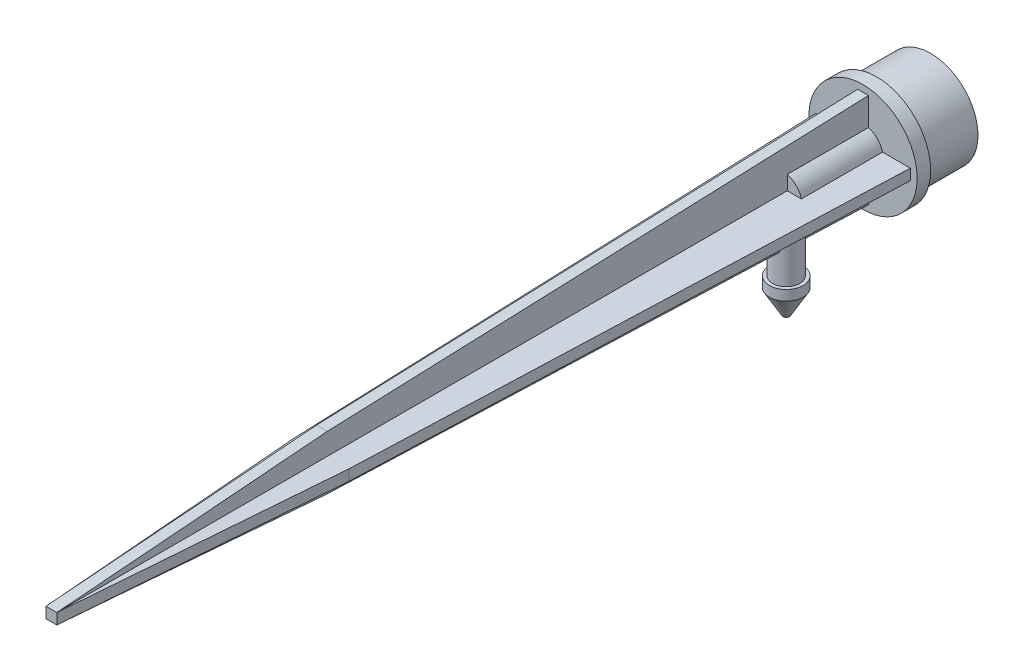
SolidWorks part; units mm, degrees
ref_plane "Plan de face" through (0, 0, 0) normal (0, 0, 1) x (1, 0, 0)
ref_plane "Plan de dessus" through (0, 0, 0) normal (0, 1, 0) x (1, 0, 0)
ref_plane "Plan de droite" through (0, 0, 0) normal (1, 0, 0) x (0, 0, -1)
sketch "Esquisse1" plane through (0, 0, 0) normal (0, 0, 1) x (1, 0, 0)
  circle A0 centre (0, 0) radius 7
  dimension "D1" = 14
extrude "Extrusion1" add sketch "Esquisse1" along normal blind 8
shell "Coque2" thickness 1
sketch "Esquisse2" plane through (0, 0, 8) normal (0, 0, 1) x (1, 0, 0)
  circle A0 centre (0, 0) radius 8
  circle A1 centre (0, 0) radius 7 construction
  dimension "D1" = 16
extrude "Extrusion2" add sketch "Esquisse2" along normal blind 2
sketch "Esquisse3" plane through (0, 0, 10) normal (0, 0, 1) x (1, 0, 0)
  circle A0 centre (0, 0) radius 3
extrude "Extrusion3" add sketch "Esquisse3" along normal blind 12
sketch "Esquisse5" plane through (0, 0, 10) normal (0, 0, 1) x (1, 0, 0)
  line L0 (0, 0) -> (0, 9.6617) construction
  line L1 (0.8, 0.8) -> (0.8, 7)
  line L3 (0.8, -0.8) -> (7, -0.8)
  line L4 (0.8, 7) -> (-0.8, 7)
  line L5 (-0.8, 0.8) -> (-0.8, 7)
  line L7 (7, -0.8) -> (7, 0.8)
  line L8 (0.8, 0.8) -> (7, 0.8)
  line L9 (0, 0) -> (9.6617, 0) construction
  line L10 (-0.8, -0.8) -> (-0.8, -7)
  line L12 (-0.8, -7) -> (0.8, -7)
  line L13 (0.8, -0.8) -> (0.8, -7)
  line L14 (0, 0) -> (0, -9.6617) construction
  line L15 (-0.8, 0.8) -> (-7, 0.8)
  line L17 (-7, 0.8) -> (-7, -0.8)
  line L18 (-0.8, -0.8) -> (-7, -0.8)
  line L19 (0, 0) -> (-9.6617, 0) construction
  line L20 (0.8, 0) -> (-0.8, 0)
  line L21 (-0.8, 0) -> (0.8, 0)
  line L22 (0, -0.8) -> (0, 0.8)
  line L23 (0, 0.8) -> (0, -0.8)
extrude "Extrusion5" add sketch "Esquisse5" along normal blind 120
sketch "Esquisse6" plane through (-0.8, 0, 0) normal (-1, 0, 0) x (0, 0, 1)
  line L0 (10, 7) -> (90, 4)
  line L1 (130, 7) -> (10, 7) construction
  line L2 (90, 4) -> (130, 0.8)
  line L4 (10, -8) -> (10, 8) construction
  line L5 (10, 7) -> (130, 7)
  line L6 (130, 7) -> (130, 0.8)
  line L7 (10, -7) -> (130, -7)
  line L8 (130, -7) -> (10, -7) construction
  line L9 (130, -7) -> (130, -0.8)
  line L10 (130, -0.8) -> (90, -4)
  line L11 (90, -4) -> (10, -7)
  dimension "D1" = 80
  dimension "D2" = 3
  dimension "D3" = 3
  dimension "D4" = 80
extrude "Enlèv. mat.-Extru.1" cut sketch "Esquisse6" against normal blind 100
sketch "Esquisse7" plane through (0, 0.8, 0) normal (0, 1, 0) x (1, 0, 0)
  line L0 (-7, -10) -> (-4, -90)
  line L1 (-4, -90) -> (-0.8, -130)
  line L2 (-0.8, -130) -> (-7, -130)
  line L3 (0.8, -130) -> (4, -90)
  line L4 (4, -90) -> (7, -10)
  line L5 (7, -10) -> (7, -130)
  line L6 (7, -130) -> (0.8, -130)
  line L7 (-7, -130) -> (-7, -10)
  line L8 (7, -10) -> (2.8914, -10) construction
  dimension "D1" = 3
  dimension "D2" = 3
  dimension "D3" = 80
extrude "Enlèv. mat.-Extru.2" cut sketch "Esquisse7" against normal blind 100
sketch "Esquisse8" plane through (0, -0.8, 0) normal (0, -1, 0) x (1, 0, 0)
  line L0 (0, 0) -> (0, 111.3725) construction
  circle A0 centre (0, 21.35) radius 2
  dimension "D1" = 4
extrude "Extrusion6" add sketch "Esquisse8" along normal blind 15
sketch "Esquisse9" plane through (0, -15.8, 0) normal (0, -1, 0) x (1, 0, 0)
  circle A0 centre (0, 21.35) radius 2.5
  dimension "D1" = 5
extrude "Extrusion7" add sketch "Esquisse9" against normal blind 5
chamfer "Chanfrein1" distance 3.5 angle 30 1 edges at (2.5, -15.8, 21.35)
shell "Coque4" thickness 0.5
